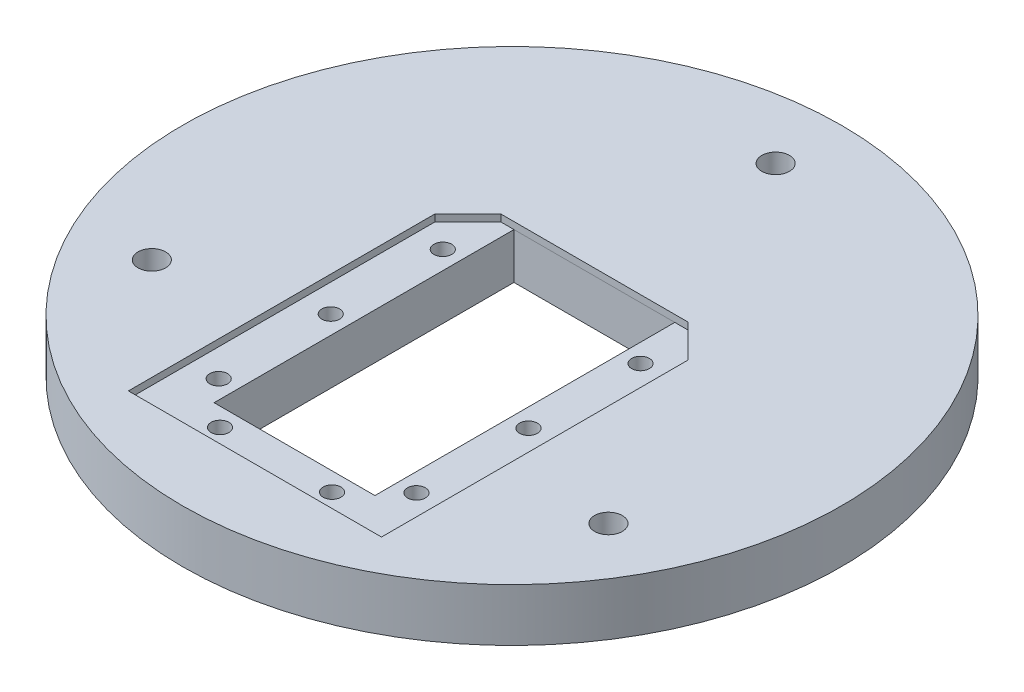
SolidWorks part; units mm, degrees
ref_plane "Спереди" through (0, 0, 0) normal (0, 0, 1) x (1, 0, 0)
ref_plane "Сверху" through (0, 0, 0) normal (0, 1, 0) x (1, 0, 0)
ref_plane "Справа" through (0, 0, 0) normal (1, 0, 0) x (0, 0, -1)
sketch "Sketch1" plane through (0, 0, 0) normal (0, 1, 0) x (1, 0, 0)
  circle A0 centre (0, 0) radius 60
  circle A9 centre (-15, 4.5) radius 1.35
  circle A10 centre (-15, -12.5) radius 1.35
  circle A11 centre (-15, -29.5) radius 1.35
  circle A12 centre (-8.5, -35.8) radius 1.35
  circle A13 centre (8.5, -35.8) radius 1.35
  circle A14 centre (15, -29.5) radius 1.35
  circle A15 centre (15, -12.5) radius 1.35
  circle A16 centre (15, 4.5) radius 1.35
  circle A17 centre (0, 0) radius 4
  dimension "D1" = 120
extrude "Boss-Extrude1" add sketch "Sketch1" along normal blind 10
sketch "Sketch2" plane through (0, 10, 0) normal (0, 1, 0) x (1, 0, 0)
  line L0 (-12.1998, 12.5002) -> (-12.2004, -32.9998)
  line L1 (-12.2004, -32.9998) -> (12.1996, -33.0002)
  line L2 (12.1996, -33.0002) -> (12.2002, 12.4998)
  line L3 (12.2002, 12.4998) -> (-12.1998, 12.5002)
  dimension "D2" = 12.2
  dimension "D1" = 12.5
  dimension "D3" = 12.2
  dimension "D4" = 33
extrude "Cut-Extrude1" cut sketch "Sketch2" against normal blind 8
sketch "Sketch6" plane through (0, 10, 0) normal (0, 1, 0) x (1, 0, 0)
  line L1 (-19.1998, 12.4998) -> (19.2002, 12.4998)
  line L2 (-19.1998, 12.4998) -> (-19.1998, -39.0002)
  line L3 (-19.1998, -39.0002) -> (19.2002, -39.0002)
  line L4 (19.2002, 12.4998) -> (19.2002, -39.0002)
  line L6 (-12.1998, 12.5002) -> (-12.2004, -32.9998) construction
  line L7 (12.1996, -33.0002) -> (12.2002, 12.4998) construction
  line L9 (12.2002, 12.4998) -> (-12.1998, 12.5002) construction
  line L10 (-12.2004, -32.9998) -> (12.1996, -33.0002) construction
  circle A0 centre (0, 0) radius 60
  dimension "D1" = 7
  dimension "D2" = 7
  dimension "D3" = 0
  dimension "D4" = 6
extrude "Boss-Extrude2" add sketch "Sketch6" along normal blind 8
chamfer "Chamfer1" distance 5 angle 45 2 edges at (-19.1998, 14, -12.4998) (19.2002, 14, -12.4998)
sketch "Sketch12" plane through (0, 2, 0) normal (0, 1, 0) x (1, 0, 0)
  line L4 (12.2002, 12.4998) -> (-12.1998, 12.5002)
  line L5 (-12.1998, 12.5002) -> (-12.2004, -32.9998)
  line L6 (-12.2004, -32.9998) -> (12.1996, -33.0002)
  line L7 (12.1996, -33.0002) -> (12.2002, 12.4998)
  line L8 (12.2002, 12.4998) -> (-12.1998, 12.5002)
  line L9 (-12.1998, 12.5002) -> (-12.2004, -32.9998)
  line L10 (-12.2004, -32.9998) -> (12.1996, -33.0002)
  line L11 (12.1996, -33.0002) -> (12.2002, 12.4998)
  dimension "D1" = 0
extrude "Cut-Extrude6" cut sketch "Sketch12" against normal through all
sketch "Sketch13" plane through (0, 18, 0) normal (0, 1, 0) x (1, 0, 0)
  line L1 (-80.6173, 67.2178) -> (78.7487, 67.2178)
  line L2 (-80.6173, 67.2178) -> (-80.6173, -71.0595)
  line L3 (-80.6173, -71.0595) -> (78.7487, -71.0595)
  line L4 (78.7487, 67.2178) -> (78.7487, -71.0595)
extrude "Cut-Extrude7" cut sketch "Sketch13" against normal blind 6.95
sketch "Sketch14" plane through (0, 0, 0) normal (0, -1, 0) x (1, 0, 0)
  circle A0 centre (-34.6403, 20.0048) radius 2.1
  circle A1 centre (34.6371, 20.0031) radius 2.1
  circle A2 centre (0.001, -39.9958) radius 2.1
  dimension "D1" = 4.2
  dimension "D2" = 4.2
  dimension "D3" = 4.2
extrude "Cut-Extrude8" cut sketch "Sketch14" against normal through all
sketch "Sketch15" plane through (0, 0, 0) normal (0, -1, 0) x (1, 0, 0)
  circle A0 centre (34.6371, 20.0031) radius 4
  circle A1 centre (-34.6403, 20.0048) radius 4
  circle A2 centre (0.001, -39.9958) radius 4
  dimension "D1" = 8
  dimension "D2" = 8
  dimension "D3" = 8
extrude "Cut-Extrude9" cut sketch "Sketch15" against normal blind 7.05
sketch "Sketch16" plane through (0, 0, 0) normal (0, -1, 0) x (1, 0, 0)
  line L1 (-78.544, 62.2347) -> (79.0308, 62.2347)
  line L2 (-78.544, 62.2347) -> (-78.544, -65.8049)
  line L3 (-78.544, -65.8049) -> (79.0308, -65.8049)
  line L4 (79.0308, 62.2347) -> (79.0308, -65.8049)
extrude "Cut-Extrude10" cut sketch "Sketch16" against normal blind 3.05
sketch "Sketch17" plane through (0, 11.05, 0) normal (0, 1, 0) x (1, 0, 0)
  circle A0 centre (0, 0) radius 50
  circle A1 centre (0, 0) radius 100
extrude "Cut-Extrude11" cut sketch "Sketch17" against normal through all
sketch "Sketch18" plane through (0, 3.05, 0) normal (0, -1, 0) x (1, 0, 0)
  circle A0 centre (15, 29.5) radius 2.25
extrude "Cut-Extrude12" cut sketch "Sketch18" against normal blind 2.5
pattern_linear "LPattern1" count 3 spacing 17 along (0, 0, -1) of "Cut-Extrude12"
sketch "Sketch19" plane through (0, 3.05, 0) normal (0, -1, 0) x (1, 0, 0)
  circle A0 centre (8.5, 35.8) radius 2.25
extrude "Cut-Extrude13" cut sketch "Sketch19" against normal blind 2.5
sketch "Sketch20" plane through (0, 3.05, 0) normal (0, -1, 0) x (1, 0, 0)
  circle A0 centre (-8.5, 35.8) radius 2.25
extrude "Cut-Extrude14" cut sketch "Sketch20" against normal blind 2.5
sketch "Sketch21" plane through (0, 3.05, 0) normal (0, -1, 0) x (1, 0, 0)
  circle A0 centre (-15, 29.5) radius 2.25
extrude "Cut-Extrude15" cut sketch "Sketch21" against normal blind 2.5
pattern_linear "LPattern2" count 3 spacing 17 along (0, 0, -1) of "Cut-Extrude15"
